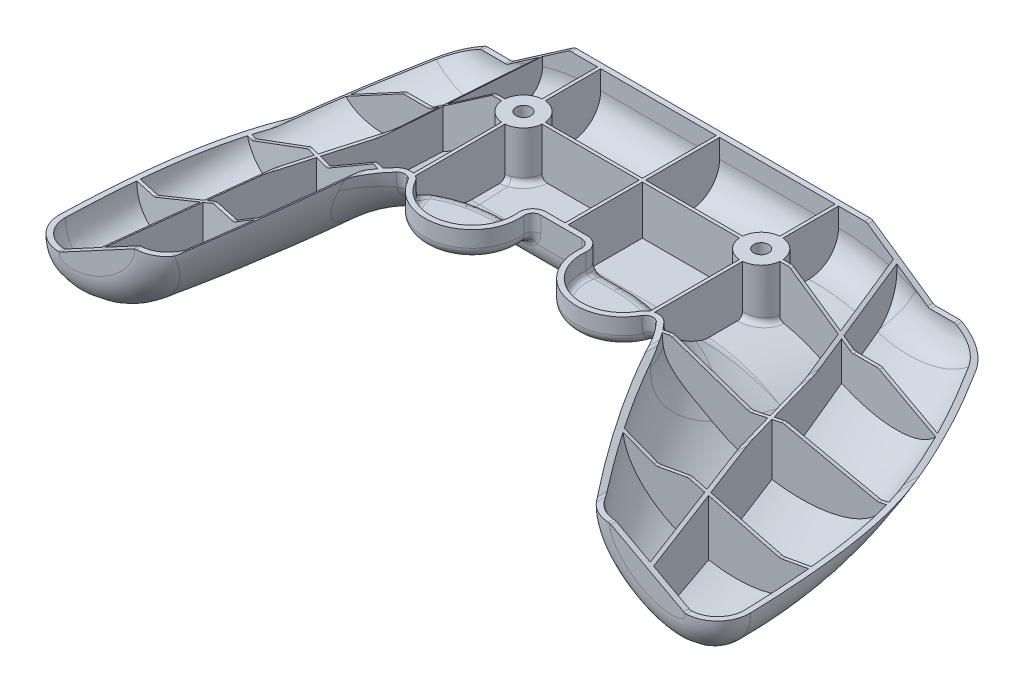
SolidWorks part; units mm, degrees
ref_plane "Front Plane" through (0, 0, 0) normal (0, 0, 1) x (1, 0, 0)
ref_plane "Top Plane" through (0, 0, 0) normal (0, 1, 0) x (1, 0, 0)
ref_plane "Right Plane" through (0, 0, 0) normal (1, 0, 0) x (0, 0, -1)
body saved out of another part "Stock-Controller Body-1"
ref_plane "Plane1" through (0, -22, 0) normal (0, -1, 0) x (-1, 0, 0)
hole_wizard "CBORE for M5 Hexagon head bolts-Full thread-grades AB1" positions "Sketch1" profile "Sketch2" counterbore size "M5" standard "GB"
sketch "Sketch1" plane through (0, -22, 0) normal (0, -1, 0) x (-1, 0, 0)
  point P0 (44, 0)
  point P3 (-44, 0)
sketch "Sketch2" plane through (-44, -22, 0) normal (1, 0, 0) x (0, 0, -1)
  line L0 (0, 0) -> (0, 31.1188)
  line L1 (0, 31.1188) -> (2.75, 31.1188)
  line L3 (2.75, 31.1188) -> (2.75, 16.8)
  line L4 (5.5, 16.8) -> (2.75, 16.8)
  line L5 (5.5, 16.8) -> (5.5, 0.025)
  line L6 (5.5, 0.025) -> (5.525, 0)
  line L7 (5.525, 0) -> (0, 0)
  line L8 (-5.5, 0.025) -> (-5.525, 0) construction
  line L11 (0, -6.35) -> (0, 107.95) construction
  dimension "Thru Hole Dia." = 5.5
  dimension "Thru Hole Depth" = 31.1188
  dimension "C'Bore Dia." = 11
  dimension "C'Bore Depth" = 16.8
  dimension "Near C'Sink Dia." = 11.05
  dimension "Near C'Sink Angle" = 90
fillet "Fillet1" radius 2 6 edges at (36.55, -18, -0.8648) (51.4845, -18.822, -0.4815) (-36.55, -18, -0.8648) (-51.1752, -18.8219, 2.1831)
sketch "Sketch3" plane through (0, 0, 0) normal (0, 1, 0) x (1, 0, 0)
  line L0 (0, 28) -> (0, -28)
  line L1 (44.3674, 28) -> (-44.3674, 28) construction
  line L2 (-7.5978, -28) -> (7.5978, -28) construction
  line L3 (-44, 28) -> (-44, -41.4594)
  line L4 (-73.0306, 28) -> (-44.3674, 28) construction
  line L17 (-65.2791, 29) -> (-101.848, -99)
  line L18 (-109.8172, 0) -> (109.8172, 0)
  line L19 (-51.1544, -45) -> (-119.2285, -27)
  line L20 (-66.743, -75) -> (-125.2773, -62)
  line L21 (44, 28) -> (44, -41.4594)
  line L22 (51.1544, -45) -> (119.2285, -27)
  line L23 (66.743, -75) -> (125.2773, -62)
  line L24 (65.2791, 29) -> (101.848, -99)
  line L29 (-7.5978, -29) -> (7.5978, -29)
  line L30 (87.8996, -99) -> (88.3463, -99)
  line L31 (88.3463, -99) -> (115.3498, -99)
  line L32 (115.3498, -99) -> (115.792, -99)
  line L33 (75.0448, 29) -> (55.5133, 29)
  line L34 (55.5133, 29) -> (54.3759, 29)
  line L35 (54.3759, 29) -> (-54.3759, 29)
  line L36 (-54.3759, 29) -> (-55.5133, 29)
  line L37 (-55.5133, 29) -> (-75.0448, 29)
  line L38 (-115.792, -99) -> (-115.3498, -99)
  line L39 (-115.3498, -99) -> (-88.3463, -99)
  line L40 (-88.3463, -99) -> (-87.8996, -99)
  line L41 (-7.5978, -29) -> (7.5978, -29) construction
  line L42 (87.8996, -99) -> (88.3463, -99) construction
  line L43 (88.3463, -99) -> (115.3498, -99) construction
  line L44 (115.3498, -99) -> (115.792, -99) construction
  line L45 (75.0448, 29) -> (55.5133, 29) construction
  line L46 (55.5133, 29) -> (54.3759, 29) construction
  line L47 (54.3759, 29) -> (-54.3759, 29) construction
  line L48 (-54.3759, 29) -> (-55.5133, 29) construction
  line L49 (-55.5133, 29) -> (-75.0448, 29) construction
  line L50 (-115.792, -99) -> (-115.3498, -99) construction
  line L51 (-115.3498, -99) -> (-88.3463, -99) construction
  line L52 (-88.3463, -99) -> (-87.8996, -99) construction
  arc A12 (-42.4155, -43.0276) -> (-11.5787, -33.3902) centre (-28, -35) ccw
  arc A13 (-7.5978, -29) -> (-11.5787, -33.3902) centre (-7.5978, -33) ccw
  arc A14 (11.5787, -33.3902) -> (7.5978, -29) centre (7.5978, -33) ccw
  arc A15 (11.5787, -33.3902) -> (42.4155, -43.0276) centre (28, -35) ccw
  arc A16 (55.2689, -51.5423) -> (48.8563, -42.2679) centre (18.6571, -70.0026) ccw
  arc A17 (56.5337, -54.2748) -> (56.4313, -54.036) centre (13.4574, -72.6047) ccw
  arc A18 (87.4404, -98.9903) -> (87.8996, -99) centre (87.901, -88.0415) ccw
  arc A19 (115.792, -99) -> (116.2556, -98.9903) centre (115.7929, -87.9626) ccw
  arc A20 (-116.2556, -98.9903) -> (-115.792, -99) centre (-115.7929, -87.9626) ccw
  arc A21 (-87.8996, -99) -> (-87.4404, -98.9903) centre (-87.901, -88.0415) ccw
  arc A22 (-56.4313, -54.036) -> (-56.5337, -54.2748) centre (-13.4574, -72.6047) ccw
  arc A23 (-48.8563, -42.2679) -> (-55.2689, -51.5423) centre (-18.6571, -70.0026) ccw
  arc A24 (-42.4155, -43.0276) -> (-11.5787, -33.3902) centre (-28, -35) ccw construction
  arc A25 (-7.5978, -29) -> (-11.5787, -33.3902) centre (-7.5978, -33) ccw construction
  arc A26 (11.5787, -33.3902) -> (7.5978, -29) centre (7.5978, -33) ccw construction
  arc A27 (11.5787, -33.3902) -> (42.4155, -43.0276) centre (28, -35) ccw construction
  arc A28 (55.2689, -51.5423) -> (48.8563, -42.2679) centre (18.6571, -70.0026) ccw construction
  arc A29 (56.5337, -54.2748) -> (56.4313, -54.036) centre (13.4574, -72.6047) ccw construction
  arc A30 (87.4404, -98.9903) -> (87.8996, -99) centre (87.901, -88.0415) ccw construction
  arc A31 (115.792, -99) -> (116.2556, -98.9903) centre (115.7929, -87.9626) ccw construction
  arc A32 (-116.2556, -98.9903) -> (-115.792, -99) centre (-115.7929, -87.9626) ccw construction
  arc A33 (-87.8996, -99) -> (-87.4404, -98.9903) centre (-87.901, -88.0415) ccw construction
  arc A34 (-56.4313, -54.036) -> (-56.5337, -54.2748) centre (-13.4574, -72.6047) ccw construction
  arc A35 (-48.8563, -42.2679) -> (-55.2689, -51.5423) centre (-18.6571, -70.0026) ccw construction
  spline S73 degree 3 poles (2315.8566, -1999.2358) (331.8259, -361.5272) (19.9051, -67.3205) (43.1798, -42.0337) (43.4235, -41.8249) (43.8143, -41.5631) (43.9495, -41.4837) (44.2295, -41.3405) (44.3754, -41.2764) (44.8204, -41.112) (45.1252, -41.0388) (45.5944, -40.983) (45.7538, -40.9737) (46.2272, -40.9738) (46.5385, -41.0108) (46.9988, -41.1215) (47.1516, -41.1679) (47.5947, -41.3319) (47.8738, -41.4744) (67.4814, -54.6104) (-25.8539, -237.2662) (-2676.1912, 1196.1054) knots -13.427162 -13.427162 -13.427162 -13.427162 0.125 0.125 0.25 0.25 0.3125 0.3125 0.375 0.375 0.5 0.5 0.5625 0.5625 0.6875 0.6875 0.75 0.75 0.875 0.875 10.078495 10.078495 10.078495 10.078495 only from (42.4155, -43.0276) to (48.8563, -42.2679)
  spline S74 degree 3 poles (-2505.6649, -1604.9946) (2507.2106, 1794.9887) (-2355.4501, -1974.8618) (2527.3793, 1641.8044) knots -71.750773 -71.750773 -71.750773 -71.750773 80.598588 80.598588 80.598588 80.598588 only from (55.2689, -51.5423) to (56.4313, -54.036)
  spline S75 degree 3 poles (2841.5665, 870.6825) (183.9219, 555.5103) (-54.4379, 142.4092) (68.3097, -77.8123) (70.2227, -81.0498) (233.8335, -342.9133) (914.5867, -276.1703) (2940.3608, 633.6991) knots -16.002058 -16.002058 -16.002058 -16.002058 0.5 0.5 0.75 0.75 21.038939 21.038939 21.038939 21.038939 only from (56.5337, -54.2748) to (78.4266, -93.6502)
  spline S76 degree 3 poles (-2429.7921, -1734.4457) (47.5681, 19.814) (46.7856, -48.4114) (78.6078, -93.9097) (78.6532, -93.9745) (78.6987, -94.0392) (110.386, -139.1373) (177.7315, -159.2578) (2552.1596, 1598.7117) knots -0.166093 -0.166093 -0.166093 -0.166093 0.000237 0.000237 0.000475 0.000475 0.000475 0.165827 0.165827 0.165827 0.165827 only from (78.4266, -93.6502) to (78.9532, -94.3997)
  spline S77 degree 3 poles (2483.1414, -1877.8774) (186.3394, 77.8625) (57.3824, -65.6257) (79.113, -94.6188) (79.1672, -94.6911) (79.2224, -94.7628) (79.2784, -94.8337) (102.3193, -123.9679) (281.1479, -31.9813) (-2123.3084, 1934.0825) knots -0.108427 -0.108427 -0.108427 -0.108427 0.000271 0.000271 0.000271 0.000542 0.000542 0.000542 0.111981 0.111981 0.111981 0.111981 only from (78.9532, -94.3997) to (79.5062, -95.1119)
  spline S78 degree 3 poles (1945.4032, 2250.5749) (440.6173, 506.4525) (24.4041, -52.563) (81.4448, -96.916) (81.7585, -97.1349) (82.4001, -97.5348) (82.7295, -97.7169) (83.4048, -98.047) (83.7508, -98.1948) (84.4598, -98.4552) (84.8246, -98.5682) (158.5735, -117.2825) (356.6389, 629.7148) (788.9234, 2814.9202) knots -23.419454 -23.419454 -23.419454 -23.419454 0.25 0.25 0.375 0.375 0.5 0.5 0.625 0.625 0.75 0.75 25.656322 25.656322 25.656322 25.656322 only from (79.5062, -95.1119) to (87.4404, -98.9903)
  spline S79 degree 3 poles (-679.0871, 2791.3193) (-92.2876, 326.7389) (61.4562, -112.4133) (118.7172, -98.6104) (119.0591, -98.5103) (119.7355, -98.2759) (120.0711, -98.1407) (121.0457, -97.6919) (121.6591, -97.3333) (122.8144, -96.4986) (123.3588, -96.0177) (124.3292, -94.9757) (124.7613, -94.4113) (125.3283, -93.4983) (125.5038, -93.1822) (125.8197, -92.5411) (125.9611, -92.2145) (126.3372, -91.2174) (126.5243, -90.5271) (139.8996, -10.6793) (-717.6052, 133.6271) (-2834.8226, 372.2111) knots -10.17213 -10.17213 -10.17213 -10.17213 0.125 0.125 0.1875 0.1875 0.25 0.25 0.375 0.375 0.5 0.5 0.625 0.625 0.6875 0.6875 0.75 0.75 0.875 0.875 14.811448 14.811448 14.811448 14.811448 only from (116.2556, -98.9903) to (126.7894, -87.6721)
  spline S80 degree 3 poles (2990.5358, -722.8477) (-118.2217, -612.5979) (144.8548, -333.9284) (125.4445, -63.2453) (124.8582, -57.1584) (123.6346, -48.0637) (123.1694, -45.0438) (122.098, -39.0411) (121.4918, -36.0572) (120.1033, -30.1328) (119.3215, -27.1922) (83.8089, 88.5436) (-118.007, 160.111) (-2850.6708, -392.8002) knots -10.590602 -10.590602 -10.590602 -10.590602 0.25 0.25 0.5 0.5 0.625 0.625 0.75 0.75 0.875 0.875 5.716403 5.716403 5.716403 5.716403 only from (126.7894, -87.6721) to (115.3712, -15.6329)
  spline S81 degree 3 poles (2241.6795, 2082.1307) (-1734.9103, -2630.2111) (1645.5882, 2877.7381) (-1072.8291, -2765.6625) knots -84.283496 -84.283496 -84.283496 -84.283496 100.833371 100.833371 100.833371 100.833371 only from (115.3712, -15.6329) to (114.397, -12.9363)
  spline S82 degree 3 poles (280.3848, 2945.6875) (-538.5804, -1060.168) (252.0805, -336.1492) (106.4184, 8.2369) (105.0891, 11.1833) (24.3637, 180.2015) (-262.2062, 247.4295) (2499.2771, 1768.9053) knots -28.154057 -28.154057 -28.154057 -28.154057 0.5 0.5 0.75 0.75 14.991577 14.991577 14.991577 14.991577 only from (114.397, -12.9363) to (99.3446, 22.7635)
  spline S83 degree 3 poles (2651.4879, 1569.5929) (-922.787, -1006.2049) (170.3664, -49.0368) (97.2037, 25.6457) (96.9996, 25.839) (96.5806, 26.2064) (96.3652, 26.3811) (95.7017, 26.8791) (95.2363, 27.176) (94.2602, 27.7011) (93.7459, 27.9301) (92.7012, 28.3108) (92.1687, 28.4642) (91.0867, 28.708) (90.5357, 28.7985) (46.2144, 33.9392) (-10.9171, -123.4157) (203.9275, 3024.7662) knots -23.156501 -23.156501 -23.156501 -23.156501 0.25 0.25 0.3125 0.3125 0.375 0.375 0.5 0.5 0.625 0.625 0.75 0.75 0.875 0.875 10.741375 10.741375 10.741375 10.741375 only from (99.3446, 22.7635) to (88.3119, 28.9845)
  spline S84 degree 3 poles (-59.3327, -2966.9905) (121.5889, 9.902) (104.9106, 28.6791) (88.0514, 28.9912) (87.9646, 28.9929) (87.8777, 28.994) (61.0069, 29.2524) (33.9541, 2.2298) (67.9318, 3028.2378) knots -0.050326 -0.050326 -0.050326 -0.050326 0.000261 0.000261 0.000261 0.000521 0.000521 0.080876 0.080876 0.080876 0.080876 only from (88.3119, 28.9845) to (87.3961, 28.997)
  spline S85 degree 3 poles (566.0277, -2909.0573) (414.3481, 3.192) (248.6883, 29.2768) (0.7428, 28.8587) (-81.5148, 18.2701) (-141.1234, -2957.1895) knots -57.03175 -57.03175 -57.03175 -57.03175 0.5 0.5 29.102732 29.102732 29.102732 29.102732 only from (87.3961, 28.997) to (78.7605, 28.9649)
  spline S86 degree 3 poles (-147.4248, -2961.3575) (154.171, 103.1679) (116.4864, 29.2254) (78.4424, 28.961) (78.3363, 28.9603) (78.2303, 28.9601) (78.1242, 28.9607) (34.7591, 29.1727) (-8.786, 141.5738) (943.978, 2898.2015) knots -0.113817 -0.113817 -0.113817 -0.113817 0.000318 0.000318 0.000318 0.000636 0.000636 0.000636 0.130739 0.130739 0.130739 0.130739 only from (78.7605, 28.9649) to (77.5784, 28.9694)
  spline S87 degree 3 poles (-68.3698, -2964.3495) (190.6054, -36.9569) (134.2705, 27.9198) (76.9312, 28.9843) (76.7154, 28.9883) (76.4997, 28.9914) (76.2839, 28.9938) (16.3107, 29.6462) (-44.3637, -27.9843) (23.0851, 3025.2878) knots -0.1714 -0.1714 -0.1714 -0.1714 0.000647 0.000647 0.000647 0.001295 0.001295 0.001295 0.181226 0.181226 0.181226 0.181226 only from (77.5784, 28.9694) to (75.0448, 29)
  spline S88 degree 3 poles (-25.2631, 3025.4324) (111.1647, -2969.1315) (-254.0079, 3027.1621) (-130.1305, -2967.6002) knots -70.397389 -70.397389 -70.397389 -70.397389 68.775651 68.775651 68.775651 68.775651 only from (-75.0448, 29) to (-77.5784, 28.9694)
  spline S89 degree 3 poles (-680.6429, 2965.8894) (-3.1143, 117.3578) (-40.0537, 29.4982) (-77.8964, 28.9628) (-78.0024, 28.9613) (-78.1084, 28.9605) (-78.2144, 28.9604) (-113.2788, 28.913) (-148.6474, 99.4554) (121.6365, -2963.2365) knots -0.113221 -0.113221 -0.113221 -0.113221 0.000318 0.000318 0.000318 0.000636 0.000636 0.000636 0.105832 0.105832 0.105832 0.105832 only from (-77.5784, 28.9694) to (-78.7605, 28.9649)
  spline S90 degree 3 poles (117.9509, -2958.8522) (81.7095, 18.2634) (-0.7247, 28.8587) (-248.6512, 29.2768) (-414.2228, 3.2037) (-578.9767, -2907.1081) knots -28.109081 -28.109081 -28.109081 -28.109081 0.5 0.5 58.018966 58.018966 58.018966 58.018966 only from (-78.7605, 28.9649) to (-87.3961, 28.997)
  spline S91 degree 3 poles (-53.9137, 3028.0496) (-31.6689, 6.009) (-59.7436, 29.1781) (-87.6569, 28.9959) (-87.7438, 28.9953) (-87.8307, 28.9945) (-87.9176, 28.9934) (-105.7303, 28.7574) (-123.5914, 13.8581) (36.7388, -2968.0051) knots -0.083481 -0.083481 -0.083481 -0.083481 0.000261 0.000261 0.000261 0.000522 0.000522 0.000522 0.053966 0.053966 0.053966 0.053966 only from (-87.3961, 28.997) to (-88.3119, 28.9845)
  spline S92 degree 3 poles (-534.8134, 2993.4631) (40.2877, -168.396) (-46.9829, 38.5586) (-92.1404, 28.4716) (-92.6719, 28.32) (-93.458, 28.0356) (-93.7193, 27.9307) (-94.2315, 27.7033) (-94.4821, 27.581) (-95.2173, 27.1875) (-95.6854, 26.8902) (-96.5761, 26.2239) (-97.0019, 25.8511) (-177.808, -56.5057) (1143.4533, -1221.5296) (-2648.8238, 1564.6387) knots -10.122401 -10.122401 -10.122401 -10.122401 0.25 0.25 0.375 0.375 0.4375 0.4375 0.5 0.5 0.625 0.625 0.75 0.75 26.493247 26.493247 26.493247 26.493247 only from (-88.3119, 28.9845) to (-99.3446, 22.7635)
  spline S93 degree 3 poles (-2465.5142, 1814.9774) (258.407, 242.9057) (-24.6221, 179.6701) (-105.0925, 11.176) (-106.4222, 8.2285) (-278.9747, -399.7872) (880.0296, -1302.5044) (-2885.5819, 393.2386) knots -13.933233 -13.933233 -13.933233 -13.933233 0.25 0.25 0.5 0.5 34.493204 34.493204 34.493204 34.493204 only from (-99.3446, 22.7635) to (-114.397, -12.9363)
  spline S94 degree 3 poles (1095.0641, -2756.1649) (-1665.4527, 2868.0257) (1751.4659, -2618.8747) (-2254.1165, 2069.5722) knots -100.077709 -100.077709 -100.077709 -100.077709 85.369721 85.369721 85.369721 85.369721 only from (-114.397, -12.9363) to (-115.3712, -15.6329)
  spline S95 degree 3 poles (2825.0939, -555.1338) (123.6567, 153.0614) (-83.0846, 90.8624) (-119.3193, -27.1838) (-120.1039, -30.134) (-121.4988, -36.0884) (-122.1064, -39.0836) (-123.1781, -45.0972) (-123.6424, -48.1167) (-124.8632, -57.2056) (-125.4478, -63.2858) (-144.915, -335.041) (119.9144, -621.633) (-3002.7569, -658.5026) knots -4.81007 -4.81007 -4.81007 -4.81007 0.125 0.125 0.25 0.25 0.375 0.375 0.5 0.5 0.75 0.75 11.657345 11.657345 11.657345 11.657345 only from (-115.3712, -15.6329) to (-126.7894, -87.6721)
  spline S96 degree 3 poles (2813.2178, 498.098) (311.9328, 89.5482) (-136.2383, -32.1107) (-126.5871, -90.1546) (-126.5118, -90.5028) (-126.3264, -91.1942) (-126.2157, -91.5387) (-125.8379, -92.5429) (-125.5241, -93.1805) (-124.7744, -94.3926) (-124.3338, -94.9701) (-123.3641, -96.0127) (-122.8321, -96.4842) (-121.9621, -97.1151) (-121.6593, -97.3129) (-121.0425, -97.6739) (-120.7269, -97.8384) (-119.7594, -98.285) (-119.0842, -98.521) (-40.2084, -117.6345) (166.0864, 731.4197) (555.6006, 2821.78) knots -10.16152 -10.16152 -10.16152 -10.16152 0.125 0.125 0.1875 0.1875 0.25 0.25 0.375 0.375 0.5 0.5 0.625 0.625 0.6875 0.6875 0.75 0.75 0.875 0.875 14.846055 14.846055 14.846055 14.846055 only from (-126.7894, -87.6721) to (-116.2556, -98.9903)
  spline S97 degree 3 poles (-795.6704, 2813.4154) (-346.0356, 575.9489) (-155.9354, -116.6053) (-84.8259, -98.5686) (-84.4605, -98.4556) (-83.7508, -98.195) (-83.4047, -98.047) (-82.7294, -97.7169) (-82.4003, -97.5346) (-81.7593, -97.1352) (-81.446, -96.9168) (-22.3944, -51.0101) (-473.6886, 544.3693) (-1951.2221, 2245.7859) knots -23.783595 -23.783595 -23.783595 -23.783595 0.25 0.25 0.375 0.375 0.5 0.5 0.625 0.625 0.75 0.75 25.231867 25.231867 25.231867 25.231867 only from (-87.4404, -98.9903) to (-79.5062, -95.1119)
  spline S98 degree 3 poles (2164.4908, 1888.7632) (-279.8928, -30.4805) (-102.623, -123.8477) (-79.3336, -94.9028) (-79.2769, -94.8324) (-79.2211, -94.7612) (-79.1663, -94.6893) (-57.2056, -65.9014) (-184.224, 78.6055) (-2518.4747, -1829.0552) knots -0.111182 -0.111182 -0.111182 -0.111182 0.000271 0.000271 0.000271 0.000542 0.000542 0.000542 0.109174 0.109174 0.109174 0.109174 only from (-79.5062, -95.1119) to (-78.9532, -94.3997)
  spline S99 degree 3 poles (-2544.6951, 1609.6345) (-181.4408, -157.3034) (-110.7253, -139.4252) (-78.77, -94.1406) (-78.7243, -94.0757) (-78.6787, -94.0108) (-46.6979, -48.4631) (-50.554, 22.2831) (2423.7848, -1743.4184) knots -0.165796 -0.165796 -0.165796 -0.165796 0.000238 0.000238 0.000476 0.000476 0.000476 0.167438 0.167438 0.167438 0.167438 only from (-78.9532, -94.3997) to (-78.4266, -93.6502)
  spline S100 degree 3 poles (-1161.7655, 2489.4922) (-1071.0339, -286.8394) (-232.6655, -372.7193) (-64.6401, -71.2283) (-62.8929, -67.8985) (39.4639, 140.2853) (-187.0509, 505.1352) (-2356.0304, 1820.0351) knots -22.18303 -22.18303 -22.18303 -22.18303 0.5 0.5 0.75 0.75 15.932506 15.932506 15.932506 15.932506 only from (-78.4266, -93.6502) to (-56.5337, -54.2748)
  spline S101 degree 3 poles (-2543.1039, 1618.4467) (2369.3717, -1953.7358) (-2519.4951, 1775.6644) (2516.4037, -1587.2622) knots -79.63777 -79.63777 -79.63777 -79.63777 72.771059 72.771059 72.771059 72.771059 only from (-56.4313, -54.036) to (-55.2689, -51.5423)
  spline S102 degree 3 poles (1707.1553, -2473.6875) (158.5635, -419.4117) (-76.4019, -60.6583) (-47.8817, -41.4791) (-47.5961, -41.3327) (-47.1552, -41.1691) (-47.0053, -41.1232) (-46.6996, -41.0492) (-46.5428, -41.0208) (-46.0717, -40.9644) (-45.7583, -40.9641) (-45.289, -41.019) (-45.1318, -41.047) (-44.6714, -41.1574) (-44.3773, -41.2657) (-43.9553, -41.4804) (-43.8175, -41.5611) (-43.4248, -41.8238) (-43.1864, -42.0273) (-27.1648, -59.3732) (-160.5863, -215.4133) (-2405.0253, 1794.8575) knots -13.427761 -13.427761 -13.427761 -13.427761 0.125 0.125 0.25 0.25 0.3125 0.3125 0.375 0.375 0.5 0.5 0.5625 0.5625 0.6875 0.6875 0.75 0.75 0.875 0.875 10.083106 10.083106 10.083106 10.083106 only from (-48.8563, -42.2679) to (-42.4155, -43.0276)
  spline S103 degree 3 poles (42.4155, -43.0276) (42.5702, -42.7499) (42.7544, -42.4959) (43.1798, -42.0337) (43.4235, -41.8249) (43.8143, -41.5631) (43.9495, -41.4837) (44.2295, -41.3405) (44.3754, -41.2764) (44.8204, -41.112) (45.1252, -41.0388) (45.5944, -40.983) (45.7538, -40.9737) (46.2272, -40.9738) (46.5385, -41.0108) (46.9988, -41.1215) (47.1516, -41.1679) (47.5947, -41.3319) (47.8738, -41.4744) (48.3993, -41.8265) (48.6413, -42.0338) (48.8563, -42.2679) knots 0 0 0 0 0.125 0.125 0.25 0.25 0.3125 0.3125 0.375 0.375 0.5 0.5 0.5625 0.5625 0.6875 0.6875 0.75 0.75 0.875 0.875 1 1 1 1 construction
  spline S104 degree 3 poles (55.2689, -51.5423) (55.6818, -52.3614) (56.0675, -53.1939) (56.4313, -54.036) knots 0 0 0 0 1 1 1 1 construction
  spline S105 degree 3 poles (56.5337, -54.2748) (59.4804, -61.1998) (62.8142, -67.9529) (68.3097, -77.8123) (70.2227, -81.0498) (74.2057, -87.4246) (76.276, -90.5626) (78.4266, -93.6502) knots 0 0 0 0 0.5 0.5 0.75 0.75 1 1 1 1 construction
  spline S106 degree 3 poles (78.4266, -93.6502) (78.6011, -93.9008) (78.7765, -94.1507) (78.9532, -94.3997) knots 0 0 0 0 0.000916 0.000916 0.000916 0.000916 construction
  spline S107 degree 3 poles (78.9532, -94.3997) (79.0055, -94.4734) (79.0588, -94.5465) (79.1672, -94.6911) (79.2224, -94.7628) (79.3528, -94.9277) (79.4287, -95.0204) (79.5062, -95.1119) knots 0 0 0 0 0.000271 0.000271 0.000542 0.000542 0.000902 0.000902 0.000902 0.000902 construction
  spline S108 degree 3 poles (79.5062, -95.1119) (79.9993, -95.6935) (80.5458, -96.217) (81.4448, -96.916) (81.7585, -97.1349) (82.4001, -97.5348) (82.7295, -97.7169) (83.4048, -98.047) (83.7508, -98.1948) (84.4598, -98.4552) (84.8246, -98.5682) (85.9294, -98.8486) (86.6786, -98.9584) (87.4404, -98.9903) knots 0 0 0 0 0.25 0.25 0.375 0.375 0.5 0.5 0.625 0.625 0.75 0.75 1 1 1 1 construction
  spline S109 degree 3 poles (116.2556, -98.9903) (116.9757, -98.96) (117.6808, -98.8602) (118.7172, -98.6104) (119.0591, -98.5103) (119.7355, -98.2759) (120.0711, -98.1407) (121.0457, -97.6919) (121.6591, -97.3333) (122.8144, -96.4986) (123.3588, -96.0177) (124.3292, -94.9757) (124.7613, -94.4113) (125.3283, -93.4983) (125.5038, -93.1822) (125.8197, -92.5411) (125.9611, -92.2145) (126.3372, -91.2174) (126.5243, -90.5271) (126.7621, -89.1075) (126.8109, -88.3924) (126.7894, -87.6721) knots 0 0 0 0 0.125 0.125 0.1875 0.1875 0.25 0.25 0.375 0.375 0.5 0.5 0.625 0.625 0.6875 0.6875 0.75 0.75 0.875 0.875 1 1 1 1 construction
  spline S110 degree 3 poles (126.7894, -87.6721) (126.6071, -81.5577) (126.3195, -75.4486) (125.4445, -63.2453) (124.8582, -57.1584) (123.6346, -48.0637) (123.1694, -45.0438) (122.098, -39.0411) (121.4918, -36.0572) (120.1033, -30.1328) (119.3215, -27.1922) (117.5339, -21.3663) (116.5286, -18.4808) (115.3712, -15.6329) knots 0 0 0 0 0.25 0.25 0.5 0.5 0.625 0.625 0.75 0.75 0.875 0.875 1 1 1 1 construction
  spline S111 degree 3 poles (115.3712, -15.6329) (115.0112, -14.7472) (114.6872, -13.8472) (114.397, -12.9363) knots 0 0 0 0 1 1 1 1 construction
  spline S112 degree 3 poles (114.397, -12.9363) (112.4331, -6.7731) (110.1981, -0.6992) (106.4184, 8.2369) (105.0891, 11.1833) (102.3038, 17.0149) (100.8474, 19.9002) (99.3446, 22.7635) knots 0 0 0 0 0.5 0.5 0.75 0.75 1 1 1 1 construction
  spline S113 degree 3 poles (99.3446, 22.7635) (98.8242, 23.7551) (98.1779, 24.6513) (97.2037, 25.6457) (96.9996, 25.839) (96.5806, 26.2064) (96.3652, 26.3811) (95.7017, 26.8791) (95.2363, 27.176) (94.2602, 27.7011) (93.7459, 27.9301) (92.7012, 28.3108) (92.1687, 28.4642) (91.0867, 28.708) (90.5357, 28.7985) (89.4267, 28.9271) (88.8701, 28.9653) (88.3119, 28.9845) knots 0 0 0 0 0.25 0.25 0.3125 0.3125 0.375 0.375 0.5 0.5 0.625 0.625 0.75 0.75 0.875 0.875 1 1 1 1 construction
  spline S114 degree 3 poles (88.3119, 28.9845) (88.2251, 28.9875) (88.1382, 28.9896) (87.9646, 28.9929) (87.8777, 28.994) (87.6593, 28.9961) (87.5277, 28.9967) (87.3961, 28.997) knots 0 0 0 0 0.000261 0.000261 0.000521 0.000521 0.000916 0.000916 0.000916 0.000916 construction
  spline S115 degree 3 poles (87.3961, 28.997) (85.9568, 29.0004) (84.5175, 29) (81.6389, 28.9951) (80.1996, 28.9895) (78.7605, 28.9649) knots 0 0 0 0 0.5 0.5 1 1 1 1 construction
  spline S116 degree 3 poles (78.7605, 28.9649) (78.6545, 28.9631) (78.4424, 28.9605) (78.2303, 28.9601) (77.9423, 28.9616) (77.7603, 28.9644) (77.5784, 28.9694) knots 0 0 0 0 0.000318 0.000636 0.000636 0.001182 0.001182 0.001182 0.001182 construction
  spline S117 degree 3 poles (77.5784, 28.9694) (77.147, 28.9814) (76.7155, 28.9891) (75.8709, 28.9983) (75.4579, 29) (75.0448, 29) knots 0 0 0 0 0.001295 0.001295 0.002534 0.002534 0.002534 0.002534 construction
  spline S118 degree 3 poles (-75.0448, 29) (-75.8895, 29) (-76.7341, 28.9928) (-77.5784, 28.9694) knots 0 0 0 0 1 1 1 1 construction
  spline S119 degree 3 poles (-77.5784, 28.9694) (-77.6844, 28.9665) (-77.7904, 28.9643) (-78.0024, 28.9613) (-78.1084, 28.9605) (-78.3964, 28.9601) (-78.5785, 28.9618) (-78.7605, 28.9649) knots 0 0 0 0 0.000318 0.000318 0.000636 0.000636 0.001182 0.001182 0.001182 0.001182 construction
  spline S120 degree 3 poles (-78.7605, 28.9649) (-80.1996, 28.9895) (-81.6389, 28.9951) (-84.5175, 29) (-85.9568, 29.0004) (-87.3961, 28.997) knots 0 0 0 0 0.5 0.5 1 1 1 1 construction
  spline S121 degree 3 poles (-87.3961, 28.997) (-87.483, 28.9968) (-87.6569, 28.9961) (-87.8307, 28.9945) (-88.0491, 28.9916) (-88.1805, 28.9891) (-88.3119, 28.9845) knots 0 0 0 0 0.000261 0.000522 0.000522 0.000916 0.000916 0.000916 0.000916 construction
  spline S122 degree 3 poles (-88.3119, 28.9845) (-89.427, 28.9461) (-90.5272, 28.8319) (-92.1404, 28.4716) (-92.6719, 28.32) (-93.458, 28.0356) (-93.7193, 27.9307) (-94.2315, 27.7033) (-94.4821, 27.581) (-95.2173, 27.1875) (-95.6854, 26.8902) (-96.5761, 26.2239) (-97.0019, 25.8511) (-98.1733, 24.6572) (-98.8221, 23.7591) (-99.3446, 22.7635) knots 0 0 0 0 0.25 0.25 0.375 0.375 0.4375 0.4375 0.5 0.5 0.625 0.625 0.75 0.75 1 1 1 1 construction
  spline S123 degree 3 poles (-99.3446, 22.7635) (-100.8476, 19.8998) (-102.3048, 17.0131) (-105.0925, 11.176) (-106.4222, 8.2285) (-110.2014, -0.7079) (-112.4332, -6.7732) (-114.397, -12.9363) knots 0 0 0 0 0.25 0.25 0.5 0.5 1 1 1 1 construction
  spline S124 degree 3 poles (-114.397, -12.9363) (-114.6872, -13.8472) (-115.0112, -14.7472) (-115.3712, -15.6329) knots 0 0 0 0 1 1 1 1 construction
  spline S125 degree 3 poles (-115.3712, -15.6329) (-116.524, -18.4694) (-117.529, -21.3516) (-119.3193, -27.1838) (-120.1039, -30.134) (-121.4988, -36.0884) (-122.1064, -39.0836) (-123.1781, -45.0972) (-123.6424, -48.1167) (-124.8632, -57.2056) (-125.4478, -63.2858) (-126.3202, -75.4641) (-126.6073, -81.5642) (-126.7894, -87.6721) knots 0 0 0 0 0.125 0.125 0.25 0.25 0.375 0.375 0.5 0.5 0.75 0.75 1 1 1 1 construction
  spline S126 degree 3 poles (-126.7894, -87.6721) (-126.8109, -88.3925) (-126.7619, -89.103) (-126.5871, -90.1546) (-126.5118, -90.5028) (-126.3264, -91.1942) (-126.2157, -91.5387) (-125.8379, -92.5429) (-125.5241, -93.1805) (-124.7744, -94.3926) (-124.3338, -94.9701) (-123.3641, -96.0127) (-122.8321, -96.4842) (-121.9621, -97.1151) (-121.6593, -97.3129) (-121.0425, -97.6739) (-120.7269, -97.8384) (-119.7594, -98.285) (-119.0842, -98.521) (-117.6853, -98.86) (-116.9756, -98.96) (-116.2556, -98.9903) knots 0 0 0 0 0.125 0.125 0.1875 0.1875 0.25 0.25 0.375 0.375 0.5 0.5 0.625 0.625 0.6875 0.6875 0.75 0.75 0.875 0.875 1 1 1 1 construction
  spline S127 degree 3 poles (-87.4404, -98.9903) (-86.6785, -98.9584) (-85.9297, -98.8486) (-84.8259, -98.5686) (-84.4605, -98.4556) (-83.7508, -98.195) (-83.4047, -98.047) (-82.7294, -97.7169) (-82.4003, -97.5346) (-81.7593, -97.1352) (-81.446, -96.9168) (-80.546, -96.2172) (-79.9993, -95.6935) (-79.5062, -95.1119) knots 0 0 0 0 0.25 0.25 0.375 0.375 0.5 0.5 0.625 0.625 0.75 0.75 1 1 1 1 construction
  spline S128 degree 3 poles (-79.5062, -95.1119) (-79.4478, -95.0429) (-79.3902, -94.9732) (-79.2769, -94.8324) (-79.2211, -94.7612) (-79.0936, -94.594) (-79.0226, -94.4975) (-78.9532, -94.3997) knots 0 0 0 0 0.000271 0.000271 0.000542 0.000542 0.000902 0.000902 0.000902 0.000902 construction
  spline S129 degree 3 poles (-78.9532, -94.3997) (-78.7765, -94.1507) (-78.6011, -93.9008) (-78.4266, -93.6502) knots 0 0 0 0 0.000916 0.000916 0.000916 0.000916 construction
  spline S130 degree 3 poles (-78.4266, -93.6502) (-74.1252, -87.4749) (-70.1352, -81.0882) (-64.6401, -71.2283) (-62.8929, -67.8985) (-59.5766, -61.1535) (-58.0072, -57.7376) (-56.5337, -54.2748) knots 0 0 0 0 0.5 0.5 0.75 0.75 1 1 1 1 construction
  spline S131 degree 3 poles (-56.4313, -54.036) (-56.0675, -53.1939) (-55.6818, -52.3614) (-55.2689, -51.5423) knots 0 0 0 0 1 1 1 1 construction
  spline S132 degree 3 poles (-48.8563, -42.2679) (-48.6413, -42.0338) (-48.403, -41.8296) (-47.8817, -41.4791) (-47.5961, -41.3327) (-47.1552, -41.1691) (-47.0053, -41.1232) (-46.6996, -41.0492) (-46.5428, -41.0208) (-46.0717, -40.9644) (-45.7583, -40.9641) (-45.289, -41.019) (-45.1318, -41.047) (-44.6714, -41.1574) (-44.3773, -41.2657) (-43.9553, -41.4804) (-43.8175, -41.5611) (-43.4248, -41.8238) (-43.1864, -42.0273) (-42.7573, -42.492) (-42.5702, -42.7499) (-42.4155, -43.0276) knots 0 0 0 0 0.125 0.125 0.25 0.25 0.3125 0.3125 0.375 0.375 0.5 0.5 0.5625 0.5625 0.6875 0.6875 0.75 0.75 0.875 0.875 1 1 1 1 construction
  point P15 (0, 0)
  dimension "D1" = 44
  dimension "D2" = 1
  dimension "D3" = 27
  dimension "D4" = 45
  dimension "D5" = 62
  dimension "D6" = 75
extrude "Ribs" add sketch "Sketch3" against normal up to body separate body thin
sketch "Sketch4" plane through (0, 0, 0) normal (0, 0, 1) x (1, 0, 0)
  line L0 (127.7943, -30.9949) -> (116.2976, -30.9949) construction
  line L1 (115.3498, -30.7561) -> (88.3463, -16.2228) construction
  line L2 (87.3985, -15.984) -> (78.7434, -15.984) construction
  line L3 (77.606, -15.6291) -> (55.6136, -0.4242) construction
  line L4 (54.3759, 0) -> (48.1198, 0) construction
  line L5 (48.1198, 0) -> (43.2892, 0) construction
  line L8 (-7.5978, 0) -> (7.5978, 0) construction
  line L9 (-7.5978, 0) -> (-10.5978, 0) construction
  line L13 (-55.6136, -0.4242) -> (-77.606, -15.6291) construction
  line L14 (-78.7434, -15.984) -> (-87.3985, -15.984) construction
  line L15 (-88.3463, -16.2228) -> (-115.3498, -30.7561) construction
  line L16 (-116.2976, -30.9949) -> (-127.7943, -30.9949) construction
  line L17 (127.7943, -30.9949) -> (116.2976, -30.9949)
  line L18 (115.3498, -30.7561) -> (88.3463, -16.2228)
  line L19 (87.3985, -15.984) -> (78.7434, -15.984)
  line L20 (77.606, -15.6291) -> (55.5133, -0.3549)
  line L21 (54.3759, 0) -> (48.1198, 0)
  line L22 (48.1198, 0) -> (43.2892, 0)
  line L23 (7.5978, 0) -> (10.5835, 0)
  line L24 (10.5835, 0) -> (43.2892, 0)
  line L25 (-7.5978, 0) -> (7.5978, 0)
  line L26 (-7.5978, 0) -> (-10.5835, 0)
  line L28 (-54.3759, 0) -> (-43.2892, 0)
  line L29 (-43.2892, 0) -> (-10.5835, 0)
  line L30 (-55.5133, -0.3549) -> (-77.606, -15.6291)
  line L31 (-78.7434, -15.984) -> (-87.3985, -15.984)
  line L32 (-88.3463, -16.2228) -> (-115.3498, -30.7561)
  line L33 (-116.2976, -30.9949) -> (-127.7943, -30.9949)
  arc A0 (116.2976, -30.9949) -> (115.3498, -30.7561) centre (116.2976, -28.9949) cw
  arc A1 (88.3463, -16.2228) -> (87.3985, -15.984) centre (87.3985, -17.984) ccw
  arc A2 (78.7434, -15.984) -> (77.606, -15.6291) centre (78.7434, -13.984) cw
  arc A3 (55.5133, -0.3549) -> (54.3759, 0) centre (54.3759, -2) ccw
  arc A4 (-54.3759, 0) -> (-55.5133, -0.3549) centre (-54.3759, -2) ccw
  arc A5 (-77.606, -15.6291) -> (-78.7434, -15.984) centre (-78.7434, -13.984) cw
  arc A6 (-87.3985, -15.984) -> (-88.3463, -16.2228) centre (-87.3985, -17.984) ccw
  arc A7 (-115.3498, -30.7561) -> (-116.2976, -30.9949) centre (-116.2976, -28.9949) cw
  dimension "D1" = 2
extrude "Rib Cuts" cut sketch "Sketch4" against normal through all both and the other way through all flip side to cut
